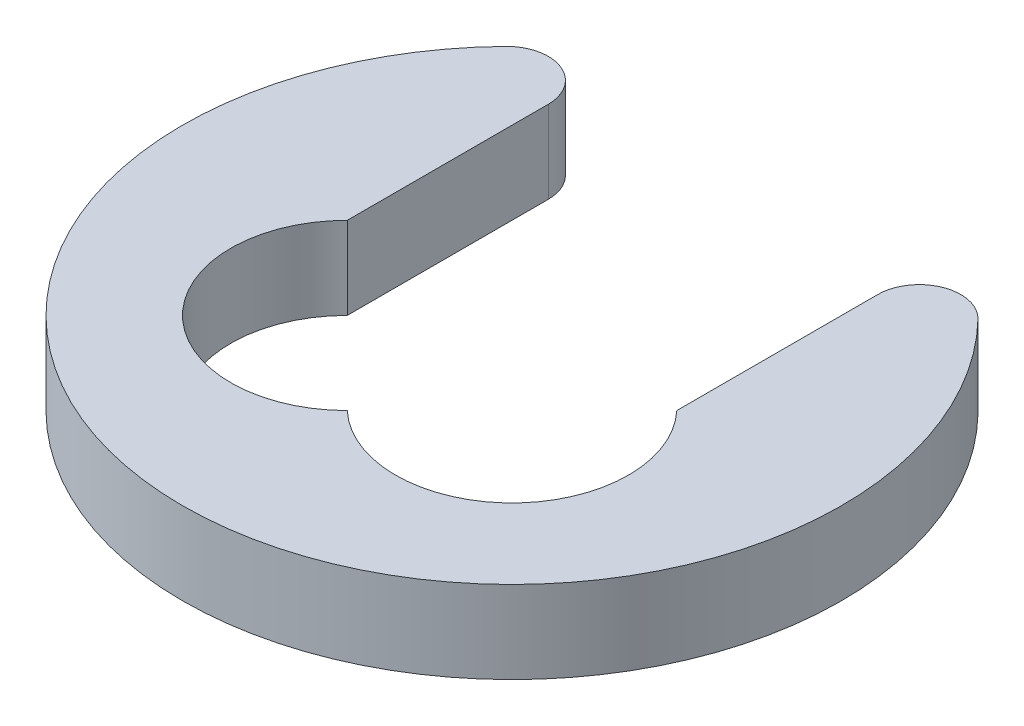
SolidWorks part; units mm, degrees
other "<Clamp.0001>-<Imported1>"
ref_plane "Front Plane" through (0, 0, 0) normal (0, 0, 1) x (1, 0, 0)
ref_plane "Top Plane" through (0, 0, 0) normal (0, 1, 0) x (1, 0, 0)
ref_plane "Right Plane" through (0, 0, 0) normal (1, 0, 0) x (0, 0, -1)
mirrored part "Clamp.0001_Mirrored"
